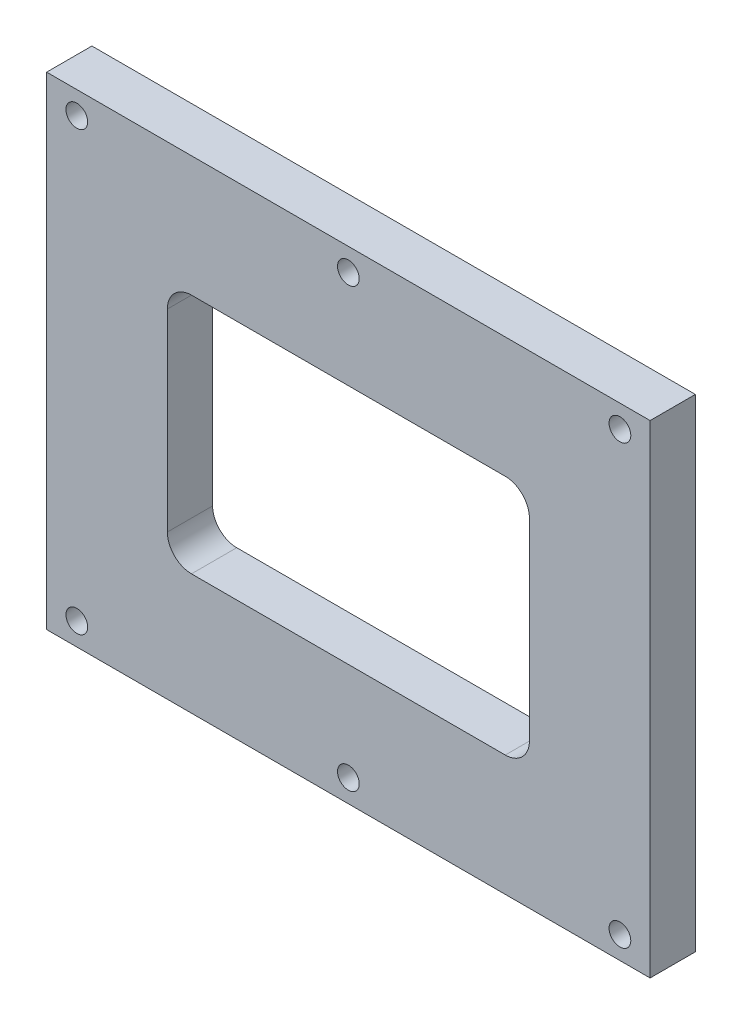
SolidWorks part; units mm, degrees
ref_plane "Front Plane" through (0, 0, 0) normal (0, 0, 1) x (1, 0, 0)
ref_plane "Top Plane" through (0, 0, 0) normal (0, 1, 0) x (1, 0, 0)
ref_plane "Right Plane" through (0, 0, 0) normal (1, 0, 0) x (0, 0, -1)
sketch "Sketch1" plane through (0, 0, 0) normal (0, 0, 1) x (1, 0, 0)
  line L1 (-31.75, -25.4) -> (31.75, -25.4)
  line L2 (-31.75, -25.4) -> (-31.75, 25.4)
  line L3 (-31.75, 25.4) -> (31.75, 25.4)
  line L4 (31.75, -25.4) -> (31.75, 25.4)
  line L5 (-31.75, -25.4) -> (31.75, 25.4) construction
  line L6 (-31.75, 25.4) -> (31.75, -25.4) construction
  point P0 (0, 0)
  dimension "D1" = 63.5
  dimension "D2" = 50.8
extrude "Boss-Extrude1" add sketch "Sketch1" along normal blind 4.7625
sketch "Sketch2" plane through (0, 0, 4.7625) normal (0, 0, 1) x (1, 0, 0)
  line L0 (-31.75, 0) -> (31.75, 0) construction
  line L1 (-31.75, 25.4) -> (-31.75, -25.4) construction
  line L2 (31.75, -25.4) -> (31.75, 25.4) construction
  line L5 (0, 25.4) -> (0, -25.4) construction
  line L6 (31.75, 25.4) -> (-31.75, 25.4) construction
  line L7 (-31.75, -25.4) -> (31.75, -25.4) construction
  circle A0 centre (-28.575, -23.0188) radius 1.143
  circle A1 centre (28.575, -23.0187) radius 1.143
  circle A2 centre (0, -23.0188) radius 1.143
  circle A3 centre (0, 23.0188) radius 1.143
  circle A4 centre (28.575, 23.0188) radius 1.143
  circle A5 centre (-28.575, 23.0188) radius 1.143
  dimension "D3" = 2.286
  dimension "D1" = 3.175
  dimension "D2" = 2.3813
extrude "Cut-Extrude1" cut sketch "Sketch2" against normal through all
sketch "Sketch3" plane through (0, 0, 4.7625) normal (0, 0, 1) x (1, 0, 0)
  line L0 (19.05, -12.7) -> (19.05, 12.7)
  line L1 (19.05, 12.7) -> (-19.05, 12.7)
  line L2 (-19.05, 12.7) -> (-19.05, -12.7)
  line L3 (-19.05, -12.7) -> (19.05, -12.7)
  line L4 (31.75, -25.4) -> (31.75, 25.4)
  line L5 (31.75, 25.4) -> (-31.75, 25.4)
  line L6 (-31.75, 25.4) -> (-31.75, -25.4)
  line L7 (-31.75, -25.4) -> (31.75, -25.4)
  line L8 (31.75, -25.4) -> (31.75, 25.4) construction
  line L9 (31.75, 25.4) -> (-31.75, 25.4) construction
  line L10 (-31.75, 25.4) -> (-31.75, -25.4) construction
  line L11 (-31.75, -25.4) -> (31.75, -25.4) construction
  dimension "D1" = 0
  dimension "D2" = 12.7
extrude "Cut-Extrude2" cut sketch "Sketch3" against normal through all
fillet "Fillet1" radius 2.54 4 edges at (19.05, 12.7, 2.3813) (19.05, -12.7, 2.3813) (-19.05, 12.7, 2.3813) (-19.05, -12.7, 2.3813)
